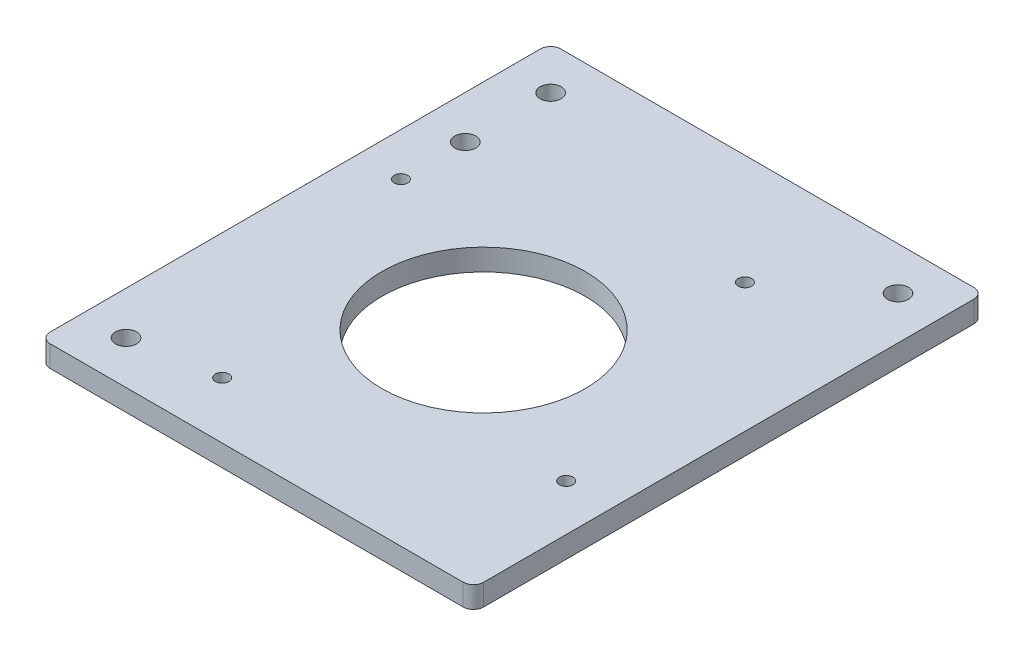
SolidWorks part; units mm, degrees
ref_plane "Front Plane" through (0, 0, 0) normal (0, 0, 1) x (1, 0, 0)
ref_plane "Top Plane" through (0, 0, 0) normal (0, 1, 0) x (1, 0, 0)
ref_plane "Right Plane" through (0, 0, 0) normal (1, 0, 0) x (0, 0, -1)
sketch "Sketch1" plane through (0, 0, 0) normal (0, 1, 0) x (1, 0, 0)
  line L0 (0.7175, -585.7621) -> (101.1273, -585.7621) construction
  line L1 (13.1273, -469.9621) -> (141.1273, -469.9621)
  line L3 (13.1273, -620.7621) -> (141.1273, -620.7621)
  line L4 (141.1273, -469.9621) -> (141.1273, -620.7621)
  line L5 (-14.8727, -585.7621) -> (101.1273, -585.7621) construction
  line L6 (101.1273, -585.7621) -> (109.1273, -577.7621) construction
  line L7 (109.1273, -577.7621) -> (109.1273, -528.7621) construction
  line L12 (109.1273, -528.7621) -> (101.1273, -520.7621) construction
  line L13 (101.1273, -520.7621) -> (0.7175, -520.7621) construction
  line L14 (101.1273, -520.7621) -> (-14.8727, -520.7621) construction
  line L16 (25.8273, -482.6621) -> (13.1273, -482.6621) construction
  line L17 (25.8273, -482.6621) -> (25.8273, -469.9621) construction
  line L18 (128.4273, -482.6621) -> (128.4273, -469.9621) construction
  line L19 (128.4273, -482.6621) -> (141.1273, -482.6621) construction
  line L20 (25.8273, -608.0621) -> (13.1273, -608.0621) construction
  line L21 (25.8273, -608.0621) -> (25.8273, -604.9621) construction
  line L22 (25.8273, -608.0621) -> (25.8273, -620.7621) construction
  line L23 (25.8273, -482.6621) -> (28.9273, -482.6621) construction
  line L24 (13.1273, -531.2621) -> (29.3273, -531.2621) construction
  line L25 (128.4273, -482.6621) -> (128.4273, -485.7621) construction
  line L30 (13.1273, -469.9621) -> (13.1273, -620.7621)
  line L31 (29.3273, -531.2621) -> (-12.8727, -531.2621) construction
  line L32 (25.8273, -482.6621) -> (25.8273, -507.8621) construction
  line L35 (-12.8727, -535.2621) -> (29.3273, -535.2621) construction
  line L36 (13.1273, -535.2621) -> (29.3273, -535.2621) construction
  line L37 (25.8273, -507.8621) -> (28.9273, -507.8621) construction
  circle A0 centre (76.6273, -553.2621) radius 30
  circle A1 centre (25.8273, -482.6621) radius 3.1
  circle A2 centre (128.4273, -482.6621) radius 3.1
  circle A4 centre (25.8273, -608.0621) radius 3.1
  arc A5 (29.3273, -535.2621) -> (29.3273, -531.2621) centre (29.3273, -533.2621) ccw construction
  circle A6 centre (25.8273, -507.8621) radius 3.1
  dimension "D4" = 60
  dimension "D5" = 88
  dimension "D6" = 6.2
  dimension "D1" = 50.8
  dimension "D2" = 35
  dimension "D3" = 32
  dimension "D7" = 12.7
  dimension "D8" = 25.2
extrude "Boss-Extrude1" add sketch "Sketch1" along normal blind 6.35
fillet "Fillet1" radius 3 4 edges at (141.1273, 3.175, 469.9621) (141.1273, 3.175, 620.7621) (13.1273, 3.175, 620.7621) (13.1273, 3.175, 469.9621)
sketch "Sketch3" plane through (0, 6.35, 0) normal (0, 1, 0) x (1, 0, 0)
  line L0 (25.8273, -482.6621) -> (25.8273, -608.0621) construction
  line L1 (25.8273, -526.8685) -> (103.0209, -502.4621) construction
  line L2 (25.8273, -526.8685) -> (50.2338, -604.0621) construction
  line L3 (50.2338, -604.0621) -> (127.4273, -579.6556) construction
  line L4 (103.0209, -502.4621) -> (127.4273, -579.6556) construction
  line L5 (25.8273, -526.8685) -> (127.4273, -579.6556) construction
  line L6 (50.2338, -604.0621) -> (103.0209, -502.4621) construction
  line L7 (12.8763, -520.1397) -> (109.7497, -489.5111) construction
  line L8 (12.8763, -520.1397) -> (43.505, -617.013) construction
  line L9 (43.505, -617.013) -> (140.3783, -586.3844) construction
  line L10 (109.7497, -489.5111) -> (140.3783, -586.3844) construction
  circle A0 centre (25.8273, -526.8685) radius 1.985
  circle A1 centre (76.6273, -553.2621) radius 30 construction
  circle A2 centre (103.0209, -502.4621) radius 1.985
  circle A3 centre (127.4273, -579.6556) radius 1.985
  circle A4 centre (50.2338, -604.0621) radius 1.985
  point P4 (76.6273, -553.2621)
  point P23 (76.6273, -553.2621)
  dimension "D5" = 3.97
  dimension "D1" = 80.96
  dimension "D2" = 101.6
  dimension "D3" = 90
  dimension "D4" = 90
  dimension "D6" = 4
extrude "Cut-Extrude1" cut sketch "Sketch3" against normal through all
